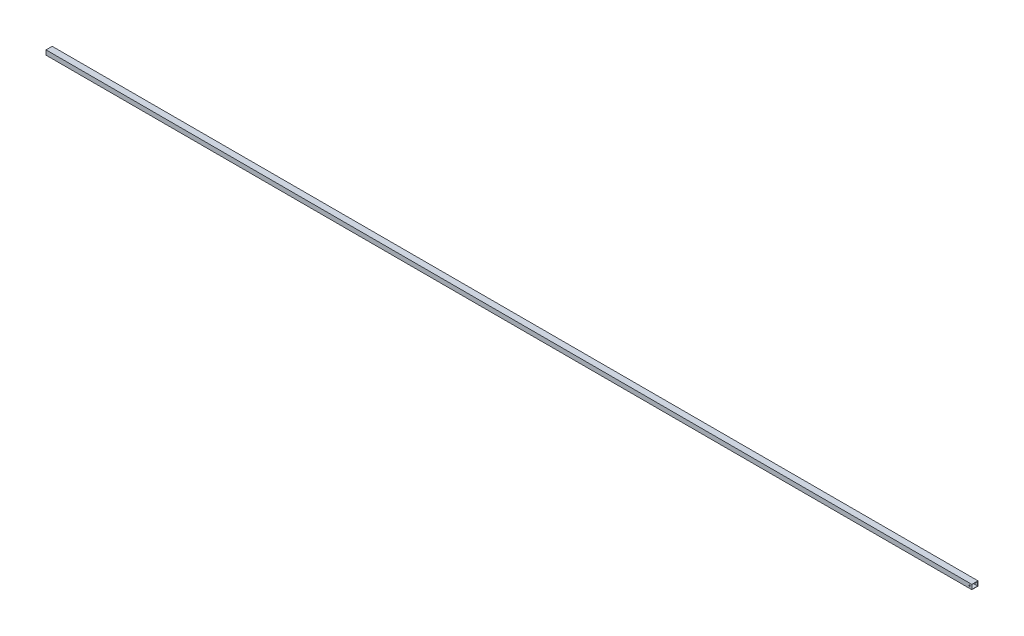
SolidWorks part; units mm, degrees
ref_plane "Front Plane" through (0, 0, 0) normal (0, 0, 1) x (1, 0, 0)
ref_plane "Top Plane" through (0, 0, 0) normal (0, 1, 0) x (1, 0, 0)
ref_plane "Right Plane" through (0, 0, 0) normal (1, 0, 0) x (0, 0, -1)
sketch "Sketch1" plane through (0, 0, 0) normal (1, 0, 0) x (0, 0, -1)
  line L0 (2, 2) -> (38, 2)
  line L1 (0, 0) -> (40, 0)
  line L2 (0, 0) -> (0, 30)
  line L3 (0, 30) -> (40, 30)
  line L4 (40, 0) -> (40, 30)
  line L5 (38, 2) -> (38, 28)
  line L6 (2, 28) -> (38, 28)
  line L7 (2, 2) -> (2, 28)
  dimension "D1" = 2
extrude "Boss-Extrude1" add sketch "Sketch1" against normal blind 6000
sketch "Sketch2" plane through (0, 0, 0) normal (0, 0, 1) x (1, 0, 0)
  circle A0 centre (-15, 15) radius 4
  dimension "D1" = 8
  dimension "D2" = 15
  dimension "D3" = 15
extrude "Cut-Extrude1" cut sketch "Sketch2" against normal through all contours A0
